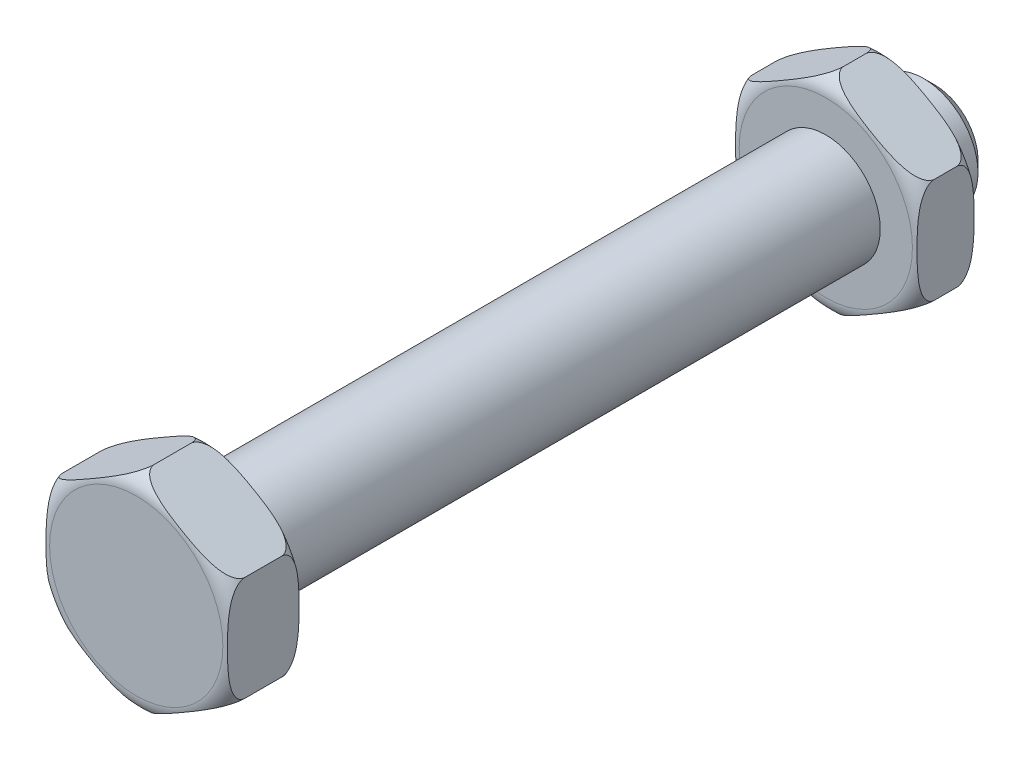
SolidWorks part; units mm, degrees
ref_plane "Plan de face" through (0, 0, 0) normal (0, 0, 1) x (1, 0, 0)
ref_plane "Plan de dessus" through (0, 0, 0) normal (0, 1, 0) x (1, 0, 0)
ref_plane "Plan de droite" through (0, 0, 0) normal (1, 0, 0) x (0, 0, -1)
imported_body "Importée3"
sketch "Esquisse1" plane through (0, 0, -20.2) normal (0, 0, -1) x (-1, 0, 0)
  circle A0 centre (0, -57) radius 3
extrude "Boss.-Extru.1" add sketch "Esquisse1" along normal blind 2.8
chamfer "Chanfrein1" distance 0.6135 angle 45 1 edges at (-3, -57, -23)
fillet "Congé1" radius 0.5 1 edges at (3, -57, 17)
